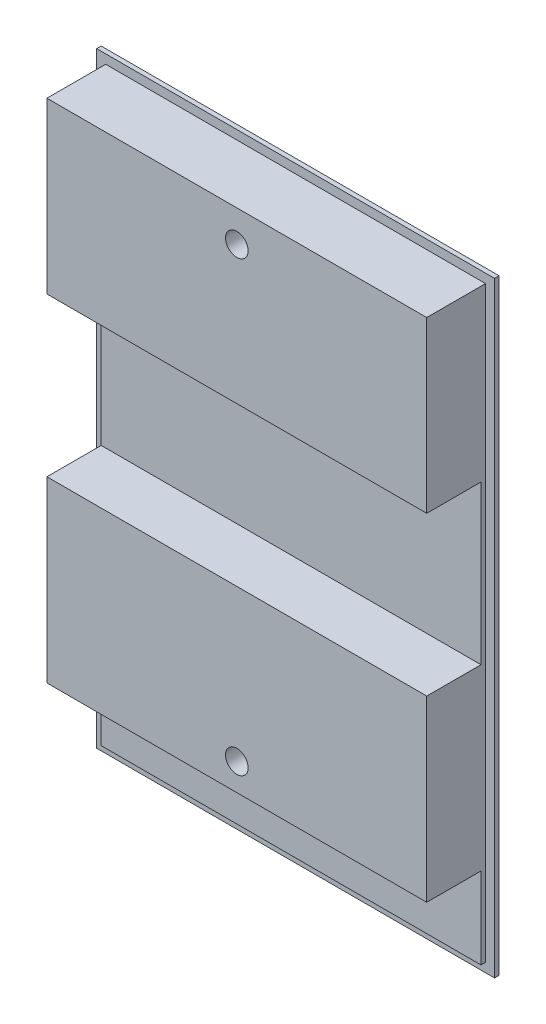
SolidWorks part; units mm, degrees
ref_plane "Ebene vorne" through (0, 0, 0) normal (0, 0, 1) x (1, 0, 0)
ref_plane "Ebene oben" through (0, 0, 0) normal (0, 1, 0) x (1, 0, 0)
ref_plane "Ebene rechts" through (0, 0, 0) normal (1, 0, 0) x (0, 0, -1)
sketch "Skizze1" plane through (0, 0, 0) normal (0, 0, 1) x (1, 0, 0)
  line L1 (-42, -65) -> (42, -65)
  line L2 (-42, -65) -> (-42, 65)
  line L3 (-42, 65) -> (42, 65)
  line L4 (42, -65) -> (42, 65)
  line L5 (-42, -65) -> (42, 65) construction
  line L6 (-42, 65) -> (42, -65) construction
  point P0 (0, 0)
  dimension "D1" = 84
  dimension "D2" = 130
extrude "Aufsatz-Linear austragen1" add sketch "Skizze1" along normal blind 2
sketch "Skizze2" plane through (0, 0, 2) normal (0, 0, 1) x (1, 0, 0)
  line L0 (-42, 0) -> (42, 0) construction
  line L1 (-42, 65) -> (-42, -65) construction
  line L2 (42, -65) -> (42, 65) construction
  line L3 (0, 65) -> (0, -65) construction
  line L4 (42, 65) -> (-42, 65) construction
  line L5 (-42, -65) -> (42, -65) construction
  line L6 (-42, -41) -> (42, -41) construction
  line L7 (-42, -47) -> (42, -47)
  line L8 (-42, 65) -> (42, 65)
  line L9 (-42, 65) -> (-42, -65)
  line L10 (-42, -65) -> (42, -65)
  line L11 (42, 65) -> (42, -65)
  line L12 (-42, -7.5) -> (42, -7.5)
  line L13 (-42, -7.5) -> (-42, 27.5)
  line L14 (-42, 27.5) -> (42, 27.5)
  line L15 (42, -7.5) -> (42, 27.5)
  circle A0 centre (0, -41) radius 2.5
  circle A1 centre (0, 58) radius 2.5
  dimension "D1" = 99
  dimension "D2" = 106
  dimension "D3" = 7
  dimension "D4" = 35
  dimension "D5" = 37.5
  dimension "D6" = 18
extrude "Aufsatz-Linear austragen2" add sketch "Skizze2" along normal blind 12 contours L14 A1 M7 M5 M6 | L12 L9 L7 A0 M5
sketch "Skizze3" plane through (0, 0, 0) normal (0, 0, -1) x (-1, 0, 0)
  line L0 (-42, -65) -> (-42, 65) construction
  line L1 (-44, -67) -> (44, -67)
  line L2 (-44, -67) -> (-44, 67)
  line L3 (-44, 67) -> (44, 67)
  line L4 (44, -67) -> (44, 67)
  line L5 (-44, -67) -> (44, 67) construction
  line L6 (-44, 67) -> (44, -67) construction
  line L7 (-42, 65) -> (42, 65) construction
  point P0 (0, 0)
  dimension "D1" = 2
  dimension "D2" = 2
extrude "Aufsatz-Linear austragen3" add sketch "Skizze3" against normal blind 1
